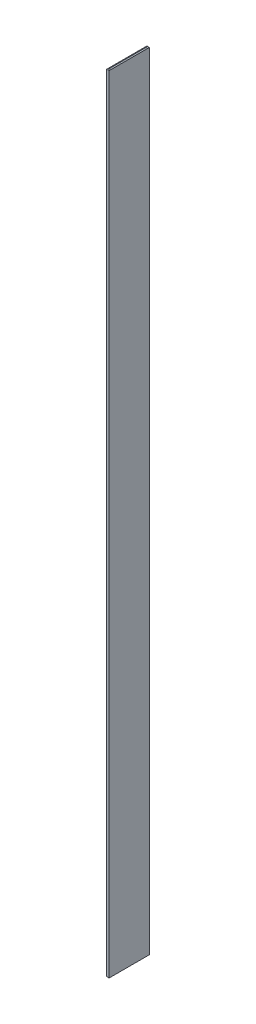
SolidWorks part; units mm, degrees
ref_plane "Front Plane" through (0, 0, 0) normal (1, 0, 0) x (0, 1, 0)
ref_plane "Top Plane" through (0, 0, 0) normal (0, 0, 1) x (0, 1, 0)
ref_plane "Right Plane" through (0, 0, 0) normal (0, 1, 0) x (-1, 0, 0)
sketch "Sketch1" plane through (0, 0, 0) normal (0, 1, 0) x (-1, 0, 0)
  line L1 (-19.05, 304.8) -> (19.05, 304.8)
  line L2 (-19.05, 304.8) -> (-19.05, -304.8)
  line L3 (-19.05, -304.8) -> (19.05, -304.8)
  line L4 (19.05, 304.8) -> (19.05, -304.8)
  line L5 (-19.05, 304.8) -> (19.05, -304.8) construction
  line L6 (-19.05, -304.8) -> (19.05, 304.8) construction
  point P0 (0, 0)
  dimension "D1" = 609.6
  dimension "D2" = 38.1
extrude "Boss-Extrude1" add sketch "Sketch1" along normal blind 11946.825
ref_plane "Mating plane" through (0, 0, -554.8) normal (0, 0, -1) x (0, 1, 0)
chamfer "Chamfer1" distance 13 angle 45 8 edges at (0, 0, 304.8) (19.05, 0, 0) (0, 0, -304.8) (-19.05, 0, 0) (0, 11946.825, -304.8) (19.05, 11946.825, 0) (0, 11946.825, 304.8) (-19.05, 11946.825, 0)
